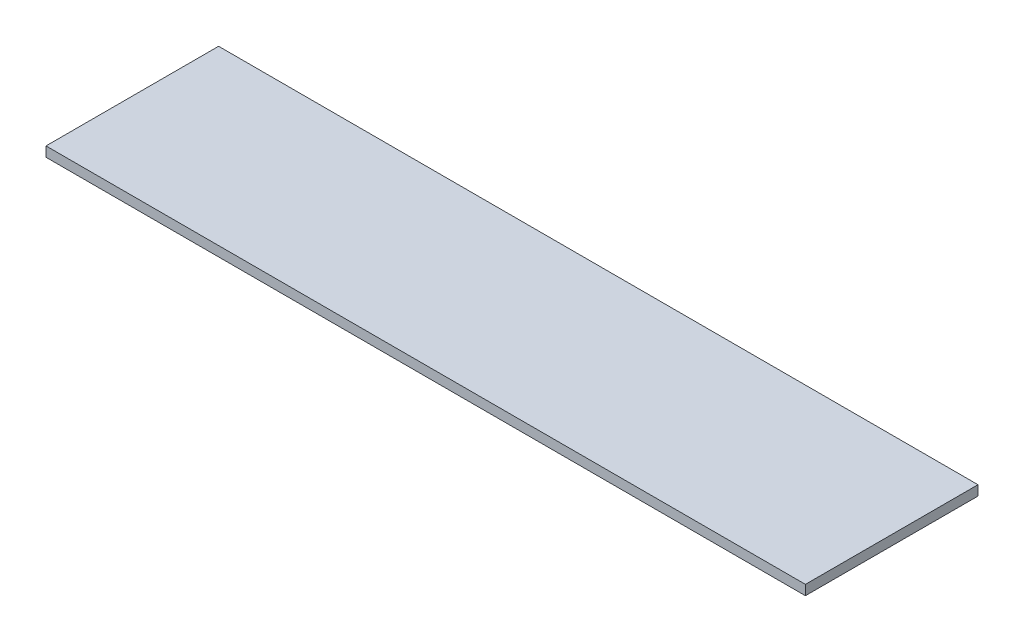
SolidWorks part; units mm, degrees
ref_plane "Plan de face" through (0, 0, 0) normal (0, 0, 1) x (1, 0, 0)
ref_plane "Plan de dessus" through (0, 0, 0) normal (0, 1, 0) x (1, 0, 0)
ref_plane "Plan de droite" through (0, 0, 0) normal (1, 0, 0) x (0, 0, -1)
sketch "Esquisse1" plane through (0, 0, 0) normal (0, 1, 0) x (1, 0, 0)
  line L1 (-770, -175) -> (770, -175)
  line L2 (-770, -175) -> (-770, 175)
  line L3 (-770, 175) -> (770, 175)
  line L4 (770, -175) -> (770, 175)
  line L5 (-770, -175) -> (770, 175) construction
  line L6 (-770, 175) -> (770, -175) construction
  point P0 (0, 0)
  dimension "D1" = 1540
  dimension "D2" = 350
extrude "Boss.-Extru.1" add sketch "Esquisse1" along normal mid plane 20
